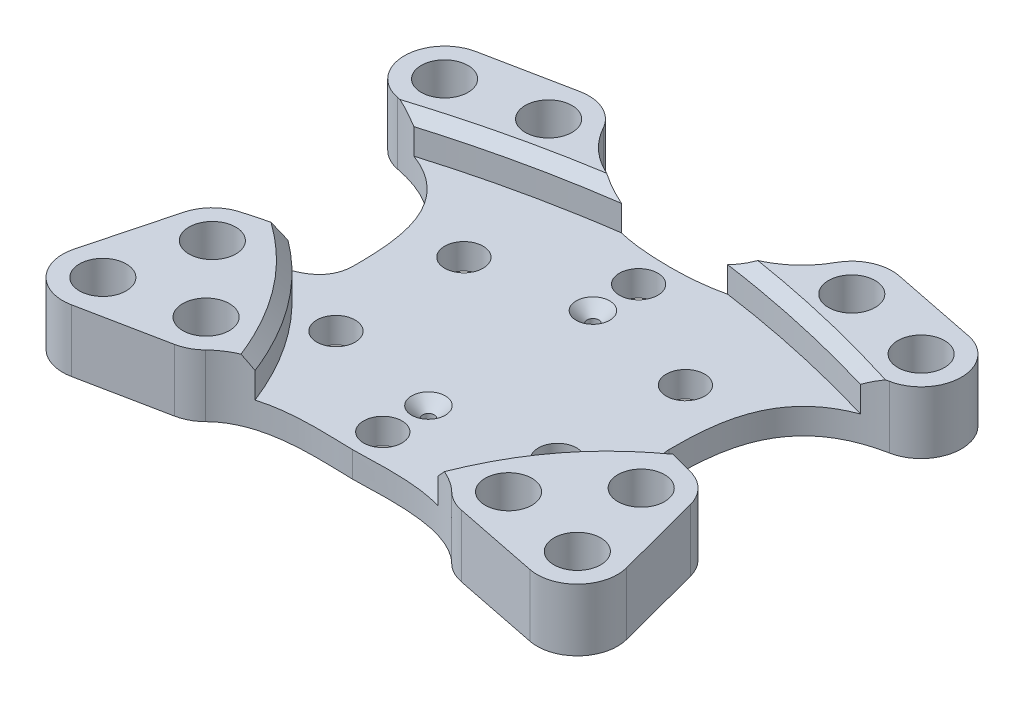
SolidWorks part; units mm, degrees
ref_plane "Спереди" through (0, 0, 0) normal (0, 0, 1) x (1, 0, 0)
ref_plane "Сверху" through (0, 0, 0) normal (0, 1, 0) x (1, 0, 0)
ref_plane "Справа" through (0, 0, 0) normal (1, 0, 0) x (0, 0, -1)
sketch "Sketch1" plane through (0, 0, 0) normal (0, 1, 0) x (1, 0, 0)
  line L0 (-0.5324, 34.9105) -> (-0.5324, -35.0895) construction
  line L1 (0, 35) -> (0, -35) construction
  line L2 (43.6342, 62.6374) -> (67.3542, 57.8934)
  line L3 (39.2198, -52.7491) -> (62.7511, -57.4691)
  line L4 (69.3043, -20.1597) -> (75.5518, -43.8825)
  line L5 (-69.3043, -20.1597) -> (-75.5518, -43.8825)
  line L6 (-39.2198, -52.7491) -> (-62.7511, -57.4691)
  line L7 (-43.6342, 62.6374) -> (-67.3542, 57.8934)
  circle A0 centre (0, 0) radius 35 construction
  circle A1 centre (0, 35) radius 5.25
  circle A2 centre (30.3109, 17.5) radius 5.25
  circle A3 centre (30.3109, -17.5) radius 5.25
  circle A4 centre (0, -35) radius 5.25
  circle A5 centre (-30.3109, -17.5) radius 5.25
  circle A6 centre (-30.3109, 17.5) radius 5.25
  circle A7 centre (65.1969, 47.107) radius 6.4
  circle A8 centre (41.4769, 51.851) radius 6.4
  arc A9 (-69.3043, -20.1597) -> (-62.2597, -12.5643) centre (-58.667, -22.961) cw
  arc A10 (-33.6508, -49.7876) -> (-39.2198, -52.7491) centre (-41.3832, -41.9639) cw
  circle A11 centre (41.3832, -41.9639) radius 6.4
  circle A12 centre (64.9144, -46.6839) radius 6.4
  circle A13 centre (58.667, -22.961) radius 6.4
  arc A14 (-62.7511, -57.4691) -> (-75.5518, -43.8825) centre (-64.9144, -46.6839) cw
  arc A15 (-67.293, 36.3086) -> (-67.3542, 57.8934) centre (-65.1969, 47.107) cw
  arc A16 (-43.6342, 62.6374) -> (-31.8691, 57.2073) centre (-41.4769, 51.851) cw
  arc A18 (43.6342, 62.6374) -> (31.8691, 57.2073) centre (41.4769, 51.851) ccw
  arc A19 (67.293, 36.3086) -> (67.3542, 57.8934) centre (65.1969, 47.107) ccw
  arc A20 (62.7511, -57.4691) -> (75.5518, -43.8825) centre (64.9144, -46.6839) ccw
  arc A21 (33.6508, -49.7876) -> (39.2198, -52.7491) centre (41.3832, -41.9639) ccw
  arc A22 (69.3043, -20.1597) -> (62.2597, -12.5643) centre (58.667, -22.961) ccw
  circle A23 centre (-58.667, -22.961) radius 6.4
  circle A24 centre (-64.9144, -46.6839) radius 6.4
  circle A25 centre (-41.3832, -41.9639) radius 6.4
  circle A26 centre (-41.4769, 51.851) radius 6.4
  circle A27 centre (-65.1969, 47.107) radius 6.4
  arc A28 (-1.947, -43.2853) -> (1.947, -43.2853) centre (0, 0) ccw
  spline S0 degree 3 poles (31.8691, 57.2073) (26.2541, 47.1354) (15.6698, 43.3291) (0, 43.3291) knots 0 0 0 0 1 1 1 1
  spline S1 degree 3 poles (43.3291, 0) (43.3291, 13.4806) (44.1138, 31.8092) (67.293, 36.3086) knots 0 0 0 0 1 1 1 1
  spline S2 degree 3 poles (43.3291, 0) (43.7456, -9.9106) (55.1015, -10.0907) (62.2597, -12.5643) knots 0 0 0 0 1 1 1 1
  spline S3 degree 3 poles (33.6508, -49.7876) (25.5272, -41.7589) (9.7206, -43.1677) (0, -43.3291) knots 0 0 0 0 1 1 1 1
  spline S4 degree 3 poles (-33.6508, -49.7876) (-25.5272, -41.7589) (-9.7206, -43.1677) (0, -43.3291) knots 0 0 0 0 1 1 1 1
  spline S5 degree 3 poles (-43.3291, 0) (-43.7456, -9.9106) (-55.1015, -10.0907) (-62.2597, -12.5643) knots 0 0 0 0 1 1 1 1
  spline S6 degree 3 poles (-43.3291, 0) (-43.3291, 13.4806) (-44.1138, 31.8092) (-67.293, 36.3086) knots 0 0 0 0 1 1 1 1
  spline S7 degree 3 poles (-31.8691, 57.2073) (-26.2541, 47.1354) (-15.6698, 43.3291) (0, 43.3291) knots 0 0 0 0 1 1 1 1
  point P18 (0, 0)
  dimension "D1" = 70
  dimension "D2" = 10.5
  dimension "D5" = 12.8
  dimension "D6" = 24
  dimension "D4" = 22
  dimension "D9" = 22
  dimension "D7" = 4.72
  dimension "D3" = 6
sketch "Sketch3" plane through (0, 0, 0) normal (0, 1, 0) x (1, 0, 0)
  line L0 (43.6342, 62.6374) -> (67.3542, 57.8934) construction
  line L1 (-43.6342, 62.6374) -> (-67.3542, 57.8934) construction
  line L2 (-69.3043, -20.1597) -> (-75.5518, -43.8825) construction
  line L3 (-39.2198, -52.7491) -> (-62.7511, -57.4691) construction
  line L4 (39.2198, -52.7491) -> (62.7511, -57.4691) construction
  line L5 (69.3043, -20.1597) -> (75.5518, -43.8825) construction
  line L6 (43.6342, 62.6374) -> (67.3542, 57.8934)
  line L7 (-43.6342, 62.6374) -> (-67.3542, 57.8934)
  line L8 (-69.3043, -20.1597) -> (-75.5518, -43.8825)
  line L9 (-39.2198, -52.7491) -> (-62.7511, -57.4691)
  line L10 (39.2198, -52.7491) -> (62.7511, -57.4691)
  line L11 (69.3043, -20.1597) -> (75.5518, -43.8825)
  circle A0 centre (41.4769, 51.851) radius 6.4 construction
  circle A1 centre (65.1969, 47.107) radius 6.4 construction
  circle A2 centre (64.9144, -46.6839) radius 6.4 construction
  circle A3 centre (41.3832, -41.9639) radius 6.4 construction
  circle A4 centre (-64.9144, -46.6839) radius 6.4 construction
  circle A5 centre (-41.3832, -41.9639) radius 6.4 construction
  circle A6 centre (-58.667, -22.961) radius 6.4 construction
  circle A7 centre (-65.1969, 47.107) radius 6.4 construction
  circle A8 centre (-41.4769, 51.851) radius 6.4 construction
  circle A9 centre (-30.3109, 17.5) radius 5.25 construction
  circle A10 centre (-30.3109, -17.5) radius 5.25 construction
  circle A11 centre (0, -35) radius 5.25 construction
  circle A12 centre (30.3109, -17.5) radius 5.25 construction
  circle A13 centre (30.3109, 17.5) radius 5.25 construction
  circle A15 centre (0, 35) radius 5.25 construction
  arc A16 (67.293, 36.3086) -> (67.3542, 57.8934) centre (65.1969, 47.107) ccw construction
  arc A17 (43.6342, 62.6374) -> (31.8691, 57.2073) centre (41.4769, 51.851) ccw construction
  arc A18 (-31.8691, 57.2073) -> (-43.6342, 62.6374) centre (-41.4769, 51.851) ccw construction
  arc A19 (-67.3542, 57.8934) -> (-67.293, 36.3086) centre (-65.1969, 47.107) ccw construction
  arc A20 (-62.2597, -12.5643) -> (-69.3043, -20.1597) centre (-58.667, -22.961) ccw construction
  arc A21 (-75.5518, -43.8825) -> (-62.7511, -57.4691) centre (-64.9144, -46.6839) ccw construction
  arc A22 (-39.2198, -52.7491) -> (-33.6508, -49.7876) centre (-41.3832, -41.9639) ccw construction
  arc A23 (33.6508, -49.7876) -> (39.2198, -52.7491) centre (41.3832, -41.9639) ccw construction
  arc A24 (62.7511, -57.4691) -> (75.5518, -43.8825) centre (64.9144, -46.6839) ccw construction
  arc A25 (69.3043, -20.1597) -> (62.2597, -12.5643) centre (58.667, -22.961) ccw construction
  circle A26 centre (58.667, -22.961) radius 6.4 construction
  circle A27 centre (41.4769, 51.851) radius 6.4
  circle A28 centre (65.1969, 47.107) radius 6.4
  circle A29 centre (64.9144, -46.6839) radius 6.4
  circle A30 centre (41.3832, -41.9639) radius 6.4
  circle A31 centre (-64.9144, -46.6839) radius 6.4
  circle A32 centre (-41.3832, -41.9639) radius 6.4
  circle A33 centre (-58.667, -22.961) radius 6.4
  circle A34 centre (-65.1969, 47.107) radius 6.4
  circle A35 centre (-41.4769, 51.851) radius 6.4
  circle A36 centre (-30.3109, 17.5) radius 5.25
  circle A37 centre (-30.3109, -17.5) radius 5.25
  circle A38 centre (0, -35) radius 5.25
  circle A39 centre (30.3109, -17.5) radius 5.25
  circle A40 centre (30.3109, 17.5) radius 5.25
  circle A42 centre (0, 35) radius 5.25
  arc A43 (67.293, 36.3086) -> (67.3542, 57.8934) centre (65.1969, 47.107) ccw
  arc A44 (43.6342, 62.6374) -> (31.8691, 57.2073) centre (41.4769, 51.851) ccw
  arc A45 (-31.8691, 57.2073) -> (-43.6342, 62.6374) centre (-41.4769, 51.851) ccw
  arc A46 (-67.3542, 57.8934) -> (-67.293, 36.3086) centre (-65.1969, 47.107) ccw
  arc A47 (-62.2597, -12.5643) -> (-69.3043, -20.1597) centre (-58.667, -22.961) ccw
  arc A48 (-75.5518, -43.8825) -> (-62.7511, -57.4691) centre (-64.9144, -46.6839) ccw
  arc A49 (-39.2198, -52.7491) -> (-33.6508, -49.7876) centre (-41.3832, -41.9639) ccw
  arc A50 (33.6508, -49.7876) -> (39.2198, -52.7491) centre (41.3832, -41.9639) ccw
  arc A51 (62.7511, -57.4691) -> (75.5518, -43.8825) centre (64.9144, -46.6839) ccw
  arc A52 (69.3043, -20.1597) -> (62.2597, -12.5643) centre (58.667, -22.961) ccw
  circle A53 centre (58.667, -22.961) radius 6.4
  spline S0 degree 3 poles (-690.3602, 679.4788) (829.3172, -786.2905) (-798.2811, 716.6352) (944.0828, -444.552) knots -3.274789 -3.274789 -3.274789 -3.274789 3.431309 3.431309 3.431309 3.431309 only from (43.3291, 0) to (67.293, 36.3086) construction
  spline S1 degree 3 poles (-251.4744, 1016.2257) (274.522, -706.406) (108.1412, 534.2117) (-981.2969, -149.1289) knots -5.075269 -5.075269 -5.075269 -5.075269 7.497209 7.497209 7.497209 7.497209 only from (31.8691, 57.2073) to (0, 43.3291) construction
  spline S2 degree 3 poles (251.4744, 1016.2257) (-274.522, -706.406) (-108.1412, 534.2117) (981.2969, -149.1289) knots -5.075269 -5.075269 -5.075269 -5.075269 7.497209 7.497209 7.497209 7.497209 only from (-31.8691, 57.2073) to (0, 43.3291) construction
  spline S3 degree 3 poles (690.3602, 679.4788) (-829.3172, -786.2905) (798.2811, 716.6352) (-944.0828, -444.552) knots -3.274789 -3.274789 -3.274789 -3.274789 3.431309 3.431309 3.431309 3.431309 only from (-43.3291, 0) to (-67.293, 36.3086) construction
  spline S4 degree 3 poles (-763.4155, 693.8795) (791.7955, -667.0031) (-920.4833, 627.4551) (697.0589, -663.2685) knots -3.032433 -3.032433 -3.032433 -3.032433 4.549446 4.549446 4.549446 4.549446 only from (-43.3291, 0) to (-62.2597, -12.5643) construction
  spline S5 degree 3 poles (618.0329, -808.2778) (-891.1999, 657.6514) (930.6242, -680.6696) (-817.7439, 532.2416) knots -3.27611 -3.27611 -3.27611 -3.27611 4.667337 4.667337 4.667337 4.667337 only from (-33.6508, -49.7876) to (0, -43.3291) construction
  spline S6 degree 3 poles (-618.0329, -808.2778) (891.1999, 657.6514) (-930.6242, -680.6696) (817.7439, 532.2416) knots -3.27611 -3.27611 -3.27611 -3.27611 4.667337 4.667337 4.667337 4.667337 only from (33.6508, -49.7876) to (0, -43.3291) construction
  spline S7 degree 3 poles (763.4155, 693.8795) (-791.7955, -667.0031) (920.4833, 627.4551) (-697.0589, -663.2685) knots -3.032433 -3.032433 -3.032433 -3.032433 4.549446 4.549446 4.549446 4.549446 only from (43.3291, 0) to (62.2597, -12.5643) construction
  spline S8 degree 3 poles (43.3291, 0) (43.3291, 13.4806) (44.1138, 31.8092) (67.293, 36.3086) knots 0 0 0 0 1 1 1 1
  spline S9 degree 3 poles (31.8691, 57.2073) (26.2541, 47.1354) (15.6698, 43.3291) (0, 43.3291) knots 0 0 0 0 1 1 1 1
  spline S10 degree 3 poles (-31.8691, 57.2073) (-26.2541, 47.1354) (-15.6698, 43.3291) (0, 43.3291) knots 0 0 0 0 1 1 1 1
  spline S11 degree 3 poles (-43.3291, 0) (-43.3291, 13.4806) (-44.1138, 31.8092) (-67.293, 36.3086) knots 0 0 0 0 1 1 1 1
  spline S12 degree 3 poles (-43.3291, 0) (-43.7456, -9.9106) (-55.1015, -10.0907) (-62.2597, -12.5643) knots 0 0 0 0 1 1 1 1
  spline S13 degree 3 poles (-33.6508, -49.7876) (-25.5272, -41.7589) (-9.7206, -43.1677) (0, -43.3291) knots 0 0 0 0 1 1 1 1
  spline S14 degree 3 poles (33.6508, -49.7876) (25.5272, -41.7589) (9.7206, -43.1677) (0, -43.3291) knots 0 0 0 0 1 1 1 1
  spline S15 degree 3 poles (43.3291, 0) (43.7456, -9.9106) (55.1015, -10.0907) (62.2597, -12.5643) knots 0 0 0 0 1 1 1 1
extrude "Boss-Extrude1" add sketch "Sketch3" along normal blind 7
sketch "Sketch4" plane through (0, 7, 0) normal (0, 1, 0) x (1, 0, 0)
  line L0 (266.6667, 600) -> (1333.3333, 600) construction
  line L1 (-43.7593, 7.3436) -> (42.2302, 6.0038) construction
  line L2 (43.6342, 62.6374) -> (67.3542, 57.8934) construction
  line L3 (39.2198, -52.7491) -> (62.7511, -57.4691) construction
  line L4 (69.3043, -20.1597) -> (75.5518, -43.8825) construction
  line L5 (43.6342, 62.6374) -> (67.3542, 57.8934)
  line L6 (39.2198, -52.7491) -> (62.7511, -57.4691)
  line L7 (69.3043, -20.1597) -> (75.5518, -43.8825)
  line L8 (0, 43.3291) -> (0, -43.3291) construction
  line L9 (-69.3043, -20.1597) -> (-75.5518, -43.8825)
  line L10 (-39.2198, -52.7491) -> (-62.7511, -57.4691)
  line L11 (-43.6342, 62.6374) -> (-67.3542, 57.8934)
  circle A0 centre (65.1969, 47.107) radius 6.4 construction
  circle A1 centre (41.4769, 51.851) radius 6.4 construction
  arc A2 (43.6342, 62.6374) -> (31.8691, 57.2073) centre (41.4769, 51.851) ccw construction
  arc A3 (67.293, 36.3086) -> (67.3542, 57.8934) centre (65.1969, 47.107) ccw construction
  circle A4 centre (58.667, -22.961) radius 6.4 construction
  circle A5 centre (64.9144, -46.6839) radius 6.4 construction
  circle A6 centre (41.3832, -41.9639) radius 6.4 construction
  arc A7 (33.6508, -49.7876) -> (39.2198, -52.7491) centre (41.3832, -41.9639) ccw construction
  arc A8 (62.7511, -57.4691) -> (75.5518, -43.8825) centre (64.9144, -46.6839) ccw construction
  arc A9 (69.3043, -20.1597) -> (62.2597, -12.5643) centre (58.667, -22.961) ccw construction
  circle A10 centre (65.1969, 47.107) radius 6.4
  circle A11 centre (41.4769, 51.851) radius 6.4
  arc A12 (43.6342, 62.6374) -> (31.8691, 57.2073) centre (41.4769, 51.851) ccw
  arc A13 (67.293, 36.3086) -> (67.3542, 57.8934) centre (65.1969, 47.107) ccw
  circle A14 centre (58.667, -22.961) radius 6.4
  circle A15 centre (64.9144, -46.6839) radius 6.4
  circle A16 centre (41.3832, -41.9639) radius 6.4
  arc A17 (33.6508, -49.7876) -> (39.2198, -52.7491) centre (41.3832, -41.9639) ccw
  arc A18 (62.7511, -57.4691) -> (75.5518, -43.8825) centre (64.9144, -46.6839) ccw
  arc A19 (69.3043, -20.1597) -> (62.2597, -12.5643) centre (58.667, -22.961) ccw
  arc A20 (-69.3043, -20.1597) -> (-62.2597, -12.5643) centre (-58.667, -22.961) cw
  arc A21 (-62.7511, -57.4691) -> (-75.5518, -43.8825) centre (-64.9144, -46.6839) cw
  arc A22 (-33.6508, -49.7876) -> (-39.2198, -52.7491) centre (-41.3832, -41.9639) cw
  circle A23 centre (-41.3832, -41.9639) radius 6.4
  circle A24 centre (-64.9144, -46.6839) radius 6.4
  circle A25 centre (-58.667, -22.961) radius 6.4
  arc A26 (-67.293, 36.3086) -> (-67.3542, 57.8934) centre (-65.1969, 47.107) cw
  arc A27 (-43.6342, 62.6374) -> (-31.8691, 57.2073) centre (-41.4769, 51.851) cw
  circle A28 centre (-41.4769, 51.851) radius 6.4
  circle A29 centre (-65.1969, 47.107) radius 6.4
  spline S0 degree 2 poles (14.5334, 44.8197) (38.268, 41.4637) (61.0919, 34.6007) knots 0 0 0 1 1 1
  spline S1 degree 3 poles (-526.0332, 1977.7281) (445.4647, -1639.2893) (229.8321, 1373.2795) (-1731.1356, -810.7237) knots -6.914408 -6.914408 -6.914408 -6.914408 9.964662 9.964662 9.964662 9.964662 only from (31.8691, 57.2073) to (0, 43.3291) construction
  spline S2 degree 3 poles (-1412.222, 1371.4124) (1583.397, -1484.729) (-1585.6633, 1374.6532) (1765.87, -1014.2431) knots -4.105357 -4.105357 -4.105357 -4.105357 4.267661 4.267661 4.267661 4.267661 only from (43.3291, 0) to (67.293, 36.3086) construction
  spline S3 degree 2 poles (25.0154, -44.9337) (33.6569, -22.8663) (51.4152, -9.5189) knots 0 0 0 1 1 1
  spline S4 degree 3 poles (-1346.4747, -1493.3472) (1698.1907, 1304.7226) (-1767.5409, -1290.3669) (1637.2298, 1105.1814) knots -4.261308 -4.261308 -4.261308 -4.261308 5.643853 5.643853 5.643853 5.643853 only from (33.6508, -49.7876) to (0, -43.3291) construction
  spline S5 degree 3 poles (1521.2963, 1346.2573) (-1589.9339, -1301.1928) (1727.0633, 1251.388) (-1480.3757, -1284.8479) knots -3.98896 -3.98896 -3.98896 -3.98896 5.504858 5.504858 5.504858 5.504858 only from (43.3291, 0) to (62.2597, -12.5643) construction
  spline S6 degree 3 poles (31.8691, 57.2073) (28.2107, 50.6451) (22.4429, 46.7426) (14.5334, 44.8197) knots 0 0 0 0 0.651537 0.651537 0.651537 0.651537
  spline S7 degree 3 poles (61.0919, 34.6007) (62.9566, 35.2916) (65.0168, 35.8668) (67.293, 36.3086) knots 0.901801 0.901801 0.901801 0.901801 1 1 1 1
  spline S8 degree 3 poles (33.6508, -49.7876) (31.3032, -47.4675) (28.314, -45.9354) (25.0154, -44.9337) knots 0 0 0 0 0.288985 0.288985 0.288985 0.288985
  spline S9 degree 3 poles (51.4152, -9.5189) (54.9595, -10.8012) (59.0354, -11.4501) (62.2597, -12.5643) knots 0.54957 0.54957 0.54957 0.54957 1 1 1 1
  spline S10 degree 3 poles (-51.4152, -9.5189) (-54.9595, -10.8012) (-59.0354, -11.4501) (-62.2597, -12.5643) knots 0.54957 0.54957 0.54957 0.54957 1 1 1 1
  spline S11 degree 3 poles (-33.6508, -49.7876) (-31.3032, -47.4675) (-28.314, -45.9354) (-25.0154, -44.9337) knots 0 0 0 0 0.288985 0.288985 0.288985 0.288985
  spline S12 degree 3 poles (-61.0919, 34.6007) (-62.9566, 35.2916) (-65.0168, 35.8668) (-67.293, 36.3086) knots 0.901801 0.901801 0.901801 0.901801 1 1 1 1
  spline S13 degree 3 poles (-31.8691, 57.2073) (-28.2107, 50.6451) (-22.4429, 46.7426) (-14.5334, 44.8197) knots 0 0 0 0 0.651537 0.651537 0.651537 0.651537
  spline S14 degree 2 poles (-25.0154, -44.9337) (-33.6569, -22.8663) (-51.4152, -9.5189) knots 0 0 0 1 1 1
  spline S15 degree 2 poles (-14.5334, 44.8197) (-38.268, 41.4637) (-61.0919, 34.6007) knots 0 0 0 1 1 1
  dimension "D1" = 86
extrude "Boss-Extrude2" add sketch "Sketch4" along normal blind 10
chamfer "Chamfer1" distance 3 angle 45 4 edges
sketch "Sketch5" plane through (0, 7, 0) normal (0, 1, 0) x (1, 0, 0)
  line L0 (0, 22.5) -> (0, -22.5) construction
  line L1 (0, 35) -> (0, -35) construction
  circle A0 centre (0, 22.5) radius 1.6
  circle A1 centre (0, -22.5) radius 1.6
  point P6 (0, 0)
  dimension "D2" = 3.2
  dimension "D1" = 45
extrude "Cut-Extrude1" cut sketch "Sketch5" against normal through all
chamfer "Chamfer2" distance 3 angle 45 2 edges at (0, 7, -20.9) (0, 7, 24.1)
